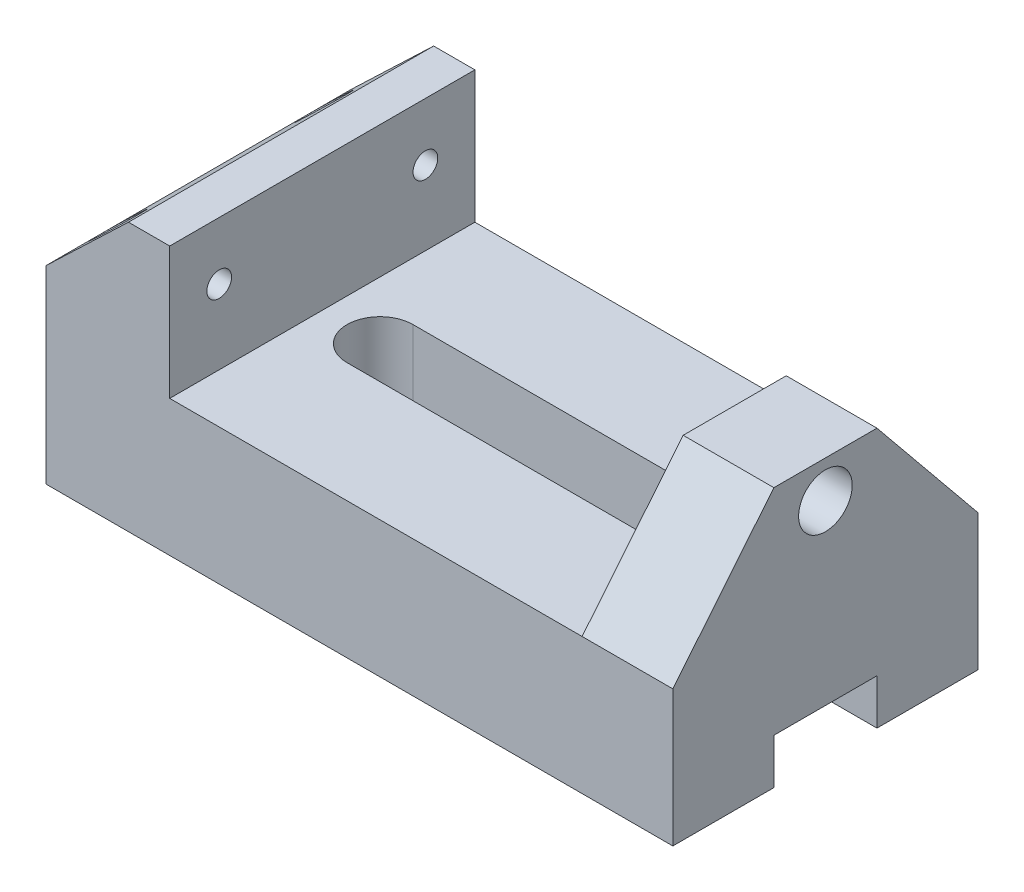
SolidWorks part; units mm, degrees
ref_plane "Front Plane" through (0, 0, 0) normal (0, 0, 1) x (1, 0, 0)
ref_plane "Top Plane" through (0, 0, 0) normal (0, 1, 0) x (1, 0, 0)
ref_plane "Right Plane" through (0, 0, 0) normal (1, 0, 0) x (0, 0, -1)
sketch "Sketch1" plane through (0, 0, 0) normal (0, 0, 1) x (1, 0, 0)
  line L1 (-76, -32.5) -> (76, -32.5)
  line L2 (-76, -32.5) -> (-76, 32.5)
  line L3 (-76, 32.5) -> (76, 32.5)
  line L4 (76, -32.5) -> (76, 32.5)
  line L5 (-76, -32.5) -> (76, 32.5) construction
  line L6 (-76, 32.5) -> (76, -32.5) construction
  point P0 (0, 0)
  dimension "D1" = 152
  dimension "D2" = 65
extrude "Boss-Extrude1" add sketch "Sketch1" along normal mid plane 74
chamfer "Chamfer1" distance 20 distance2 18 1 edges at (-76, 32.5, 0)
sketch "Sketch2" plane through (0, 0, 37) normal (0, 0, 1) x (1, 0, 0)
  line L1 (76, 32.5) -> (-56, 32.5) construction
  line L2 (-46, 32.5) -> (-46, 0.5)
  line L3 (-46, 0.5) -> (54, 0.5)
  line L4 (54, 0.5) -> (54, 32.5)
  line L5 (54, 32.5) -> (-46, 32.5)
  line L6 (76, -32.5) -> (76, 32.5) construction
  dimension "D1" = 22
  dimension "D2" = 10
  dimension "D3" = 32
extrude "Cut-Extrude1" cut sketch "Sketch2" against normal up to surface (74 mm away)
chamfer "Chamfer2" distance 26.135 distance2 32 1 edges at (65, 32.5, 37)
chamfer "Chamfer3" distance 32 distance2 26.135 1 edges at (65, 32.5, -37)
sketch "Sketch3" plane through (76, 0, 0) normal (1, 0, 0) x (0, 0, -1)
  line L0 (-12.5, -21.5) -> (12.5, -21.5)
  line L1 (-37, -32.5) -> (37, -32.5) construction
  line L2 (-12.5, -21.5) -> (-12.5, -32.5)
  line L3 (12.5, -21.5) -> (12.5, -32.5)
  line L4 (-12.5, -32.5) -> (12.5, -32.5)
  point P3 (0, -21.5)
  dimension "D1" = 11
  dimension "D2" = 12.5
extrude "Cut-Extrude2" cut sketch "Sketch3" against normal up to surface (152 mm away)
sketch "Sketch4" plane through (76, 0, 0) normal (1, 0, 0) x (0, 0, -1)
  line L0 (-10.865, 32.5) -> (10.865, 32.5) construction
  circle A0 centre (0, 21.5) radius 6.5
  dimension "D2" = 13
  dimension "D1" = 11
extrude "Cut-Extrude3" cut sketch "Sketch4" against normal up to surface (22 mm away)
sketch "Sketch5" plane through (-76, 0, 0) normal (-1, 0, 0) x (0, 0, 1)
  line L0 (-12.5, -32.5) -> (-37, -32.5) construction
  circle A0 centre (0, -7.5) radius 8
  dimension "D2" = 16
  dimension "D1" = 25
extrude "Cut-Extrude4" cut sketch "Sketch5" against normal blind 13
sketch "Sketch6" plane through (0, 0.5, 0) normal (0, 1, 0) x (1, 0, 0)
  line L0 (-32, 0) -> (46, 0) construction
  line L2 (-32, 8) -> (46, 8)
  line L3 (-32, -8) -> (46, -8)
  line L4 (54, 37) -> (54, -37) construction
  arc A0 (-32, 8) -> (-32, -8) centre (-32, 0) ccw
  arc A1 (46, -8) -> (46, 8) centre (46, 0) ccw
  point P4 (7, 0)
  dimension "D1" = 78
  dimension "D2" = 16
extrude "Cut-Extrude5" cut sketch "Sketch6" against normal up to surface (22 mm away)
sketch "Sketch14" plane through (0, 32.5, 0) normal (0, 1, 0) x (1, 0, 0)
  line L4 (-56, -37) -> (-46, -37)
  line L6 (-56, -37) -> (-46, -37)
  line L12 (-46, -37) -> (-46, 37)
  line L14 (-46, -37) -> (-46, 37)
  line L16 (-46, 37) -> (-56, 37)
  line L17 (-46, 37) -> (-56, 37)
  line L18 (-56, 37) -> (-56, -37)
  line L19 (-56, 37) -> (-56, -37)
  dimension "D1" = 0
extrude "Boss-Extrude3" add sketch "Sketch14" along normal blind 2
sketch "Sketch15" plane through (0, 0, 37) normal (0, 0, 1) x (1, 0, 0)
  line L0 (-56, 34.5) -> (-76, 14.5)
  line L1 (-76, 14.5) -> (-56, 14.5)
  line L2 (-56, 14.5) -> (-56, 34.5)
  line L3 (-46, 34.5) -> (-46, 0.5) construction
  dimension "D1" = 10
extrude "Boss-Extrude4" add sketch "Sketch15" against normal up to surface (74 mm away)
sketch "Sketch24" plane through (-45.25, 45.25, 0) normal (-0.7071, 0.7071, 0) x (0, 0, 1)
  line L0 (37, -8.1317) -> (37, -32.1734) construction
  line L2 (-37, -15.2028) -> (37, -15.2028) construction
  point P0 (25, -34.9928)
  dimension "D1" = 12
  dimension "D2" = 19.79
sketch "Sketch28" plane through (-76, 0, 0) normal (-1, 0, 0) x (0, 0, 1)
  line L1 (-37, 34.5) -> (37, 34.5) construction
  point P0 (25, 18.5)
  dimension "D1" = 16
  dimension "D2" = 16
hole_wizard "CBORE for M6 Cheese Head Screw1" positions "Sketch28" profile "Sketch29" counterbore size "M6" standard "ISO"
sketch "Sketch29" plane through (-76, 18.5, 25) normal (0, 1, 0) x (0, 0, 1)
  line L0 (0, 0) -> (0, 31.8026)
  line L1 (0, 31.8026) -> (3, 30)
  line L2 (3, 30) -> (3, 16.06)
  line L3 (3, 16.06) -> (5, 16.06)
  line L4 (5, 16.06) -> (5, 0)
  line L5 (5, 0) -> (0, 0)
  line L10 (0, 31.8026) -> (-3, 30) construction
  line L11 (0, -6.35) -> (0, 107.95) construction
  dimension "Hole Dia." = 6
  dimension "Hole Depth" = 30
  dimension "C'Bore Dia." = 10
  dimension "C'Bore Depth" = 16.06
  dimension "Drill Angle" = 118
mirror "Mirror1" about plane through (0, 0, 0) normal (0, 0, 1) of "CBORE for M6 Cheese Head Screw1"
sketch "Sketch30" plane through (0, 0, -37) normal (0, 0, -1) x (-1, 0, 0)
  text T0 "MOHAMMAD AMIN SHARIF"
extrude "Cut-Extrude6" cut sketch "Sketch30" against normal blind 2
sketch "Sketch31" plane through (0, 0, 37) normal (0, 0, 1) x (1, 0, 0)
  line L0 (-46, 32.5) -> (-58, 32.5)
  line L1 (-46, 34.5) -> (-46, 0.5) construction
  line L2 (-56, 34.5) -> (-76, 14.5) construction
  line L3 (-58, 32.5) -> (-56, 34.5)
  line L4 (-56, 34.5) -> (-46, 34.5)
  line L5 (-46, 34.5) -> (-46, 32.5)
  dimension "D1" = 2
extrude "Cut-Extrude7" cut sketch "Sketch31" against normal up to surface (74 mm away)
sketch "Sketch32" plane through (76, 0, 0) normal (1, 0, 0) x (0, 0, -1)
  line L0 (-12.4984, 30.5) -> (12.4984, 30.5)
  line L1 (-10.865, 32.5) -> (-37, 0.5) construction
  line L2 (37, 0.5) -> (10.865, 32.5) construction
  line L3 (12.4984, 30.5) -> (10.865, 32.5)
  line L4 (10.865, 32.5) -> (-10.865, 32.5)
  line L5 (-10.865, 32.5) -> (-12.4984, 30.5)
  dimension "D1" = 2
extrude "Cut-Extrude8" cut sketch "Sketch32" against normal up to surface (22 mm away)
sketch "Sketch33" plane through (0, 0, 37) normal (0, 0, 1) x (1, 0, 0)
  line L0 (-56, 33.3903) -> (-56, 32.5)
  line L4 (-46, 32.5) -> (-46, 0.5) construction
  line L7 (-76, 14.5) -> (-76, -32.5) construction
  line L8 (-76, 13.3903) -> (-56, 32.5)
  line L9 (-58, 32.5) -> (-46, 32.5) construction
  line L10 (-56, 32.5) -> (-60.8341, 32.5)
  line L11 (-60.8341, 32.5) -> (-76, 15.2781)
  line L12 (-76, 15.2781) -> (-76, 13.3903)
  dimension "D1" = 10
extrude "Cut-Extrude10" cut sketch "Sketch33" against normal up to surface (74 mm away) contours L10 L11 L12 L8
